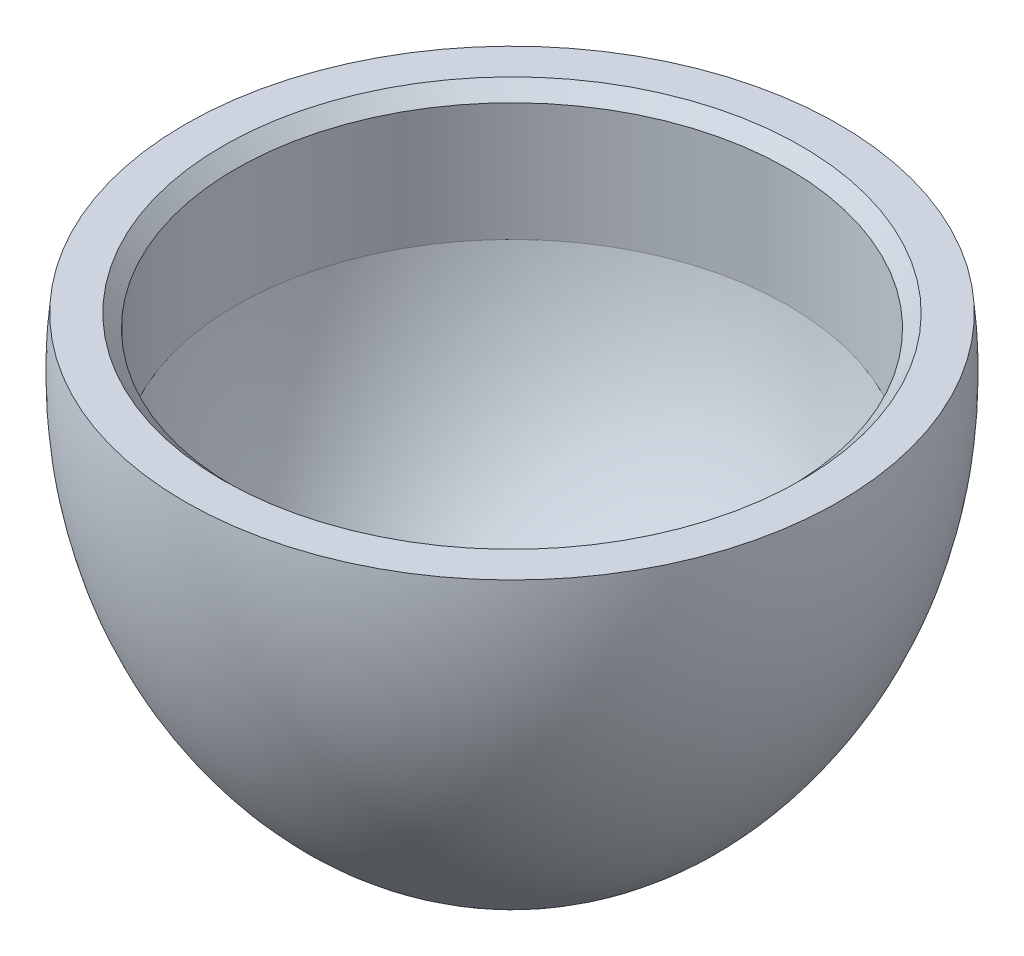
SolidWorks part; units mm, degrees
ref_plane "Front Plane" through (0, 0, 0) normal (0, 0, 1) x (1, 0, 0)
ref_plane "Top Plane" through (0, 0, 0) normal (0, 1, 0) x (1, 0, 0)
ref_plane "Right Plane" through (0, 0, 0) normal (1, 0, 0) x (0, 0, -1)
ref_plane "Overlap Plane" through (0, -10, 0) normal (0, 1, 0) x (1, 0, 0)
sketch "Sketch3" plane through (0, 0, 0) normal (0, 0, 1) x (1, 0, 0)
  line L0 (24.6, 124.6) -> (95.0695, 124.6) construction
  line L1 (0, 33.437) -> (0, -51.8457) construction
  line L2 (0, -19.8647) -> (0, 18.7433)
  spline S0 degree 3 poles (0, 18.7433) (-1.3722, 18.7433) (-4.5451, 17.7845) (-8.8778, 13.2617) (-11.2201, 9.1437) (-14.6755, -0.9262) (-12.9896, -13.0562) (-5.3082, -20.0572) (0, -19.8647) knots 0 0 0 0 0.097127 0.127739 0.306118 0.478065 0.702771 1 1 1 1
  dimension "D1" = 13.7295
  dimension "D2" = 38.608
revolve "Revolve1" add sketch "Sketch3" angle 360 about L1
scale "Scale1" scale about centroid uniform scaling yes scale factor 1.8
sketch "Sketch4" plane through (0, 0, 0) normal (0, 1, 0) x (1, 0, 0)
  circle A0 centre (0, 0) radius 39.8037
extrude "Cut-Extrude1" cut sketch "Sketch4" along normal through all
sketch "Sketch5" plane through (0, 0, 0) normal (0, 1, 0) x (1, 0, 0)
  circle A0 centre (0, 0.0002) radius 21
  dimension "D1" = 42
extrude "Cut-Extrude2" cut sketch "Sketch5" against normal up to surface (10 mm away)
sketch "Sketch7" plane through (0, 0, 0) normal (0, 0, 1) x (1, 0, 0)
  line L0 (0, 0) -> (0, -46.7356) construction
  line L1 (21, -10) -> (-21, -10) construction
  line L2 (-21.0521, -10) -> (0, -10)
  line L3 (0, -10) -> (0, -31.5514)
  spline S0 degree 2 poles (0, -31.5514) (-17.1584, -28.6864) (-21.0521, -10) knots 0 0 0 1 1 1
  dimension "D1" = 3
revolve "Cut-Revolve1" cut sketch "Sketch7" angle 360 about L0
chamfer "Chamfer1" distance 1 angle 45 1 edges at (0, 0, 20.9998)
